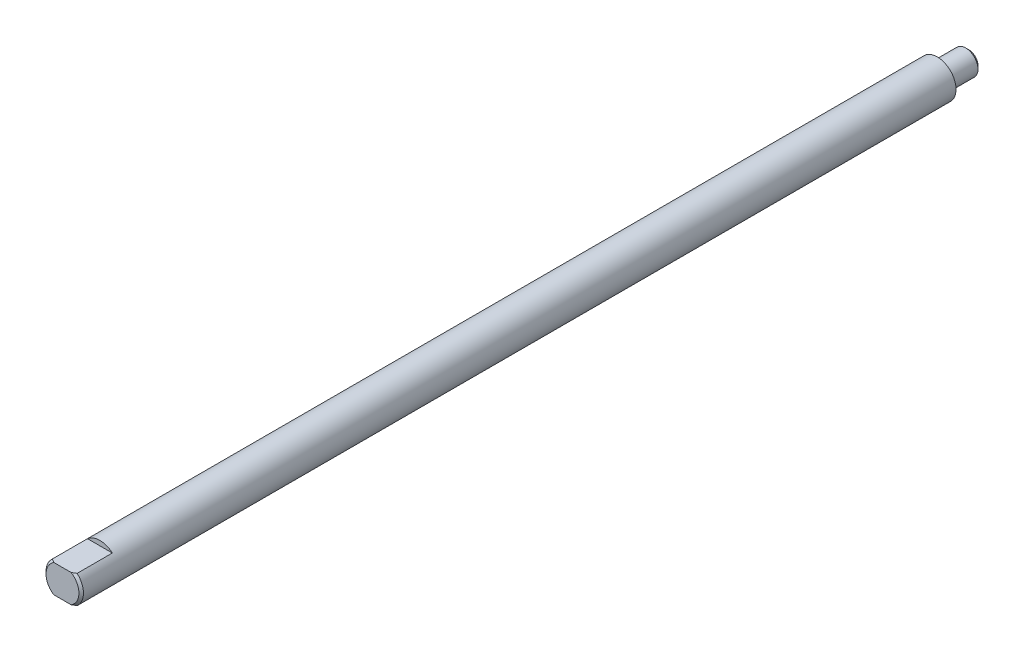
SolidWorks part; units mm, degrees
ref_plane "Front" through (0, 0, 0) normal (0, 0, 1) x (1, 0, 0)
ref_plane "Top" through (0, 0, 0) normal (0, 1, 0) x (1, 0, 0)
ref_plane "Right" through (0, 0, 0) normal (1, 0, 0) x (0, 0, -1)
sketch "Sketch1" plane through (0, 0, 0) normal (1, 0, 0) x (0, 0, -1)
  line L0 (149.6528, 1.5728) -> (149.1428, 2.0828)
  line L1 (-4.064, 0) -> (149.6528, 0)
  line L2 (-4.064, 0) -> (-4.064, 2.79)
  line L3 (-3.684, 3.175) -> (144.3228, 3.175)
  line L4 (144.3228, 2.0828) -> (144.3228, 3.175)
  line L5 (153.7168, 0) -> (50153.7168, 0) construction
  line L6 (-4.064, 2.79) -> (-3.684, 3.175)
  line L7 (144.3228, 2.0828) -> (149.1428, 2.0828)
  line L8 (149.6528, 0) -> (149.6528, 1.5728)
  point P2 (0, 0)
  point P12 (-4.167, 6.2313)
  dimension "D1" = 148.3868
  dimension "D2" = 5.33
  dimension "D3" = 6.35
  dimension "D4" = 4.1656
  dimension "D5" = 45
  dimension "D6" = 0.51
  dimension "D7" = 2.79
  dimension "D8" = 0.38
  dimension "D9" = 4.064
revolve "Revolve1" add sketch "Sketch1" angle 360 about L1
sketch "Sketch2" plane through (0, 0, 0) normal (1, 0, 0) x (0, 0, -1)
  line L0 (-4.064, 2.79) -> (-4.064, -2.79) construction
  line L1 (-4.064, 2.375) -> (2.286, 2.375)
  line L2 (-4.064, 2.375) -> (-4.064, 3.175)
  line L3 (-4.064, 3.175) -> (2.286, 3.175)
  line L4 (2.286, 2.375) -> (2.286, 3.175)
  line L5 (144.3228, 3.175) -> (-3.684, 3.175) construction
  line L6 (-4.064, 0) -> (6.0404, 0) construction
  line L7 (2.286, -2.375) -> (2.286, -3.175)
  line L8 (-4.064, -3.175) -> (2.286, -3.175)
  line L9 (-4.064, -2.375) -> (-4.064, -3.175)
  line L10 (-4.064, -2.375) -> (2.286, -2.375)
  dimension "D1" = 0.8
  dimension "D2" = 6.35
extrude "Cut-Extrude1" cut sketch "Sketch2" against normal mid plane 10
